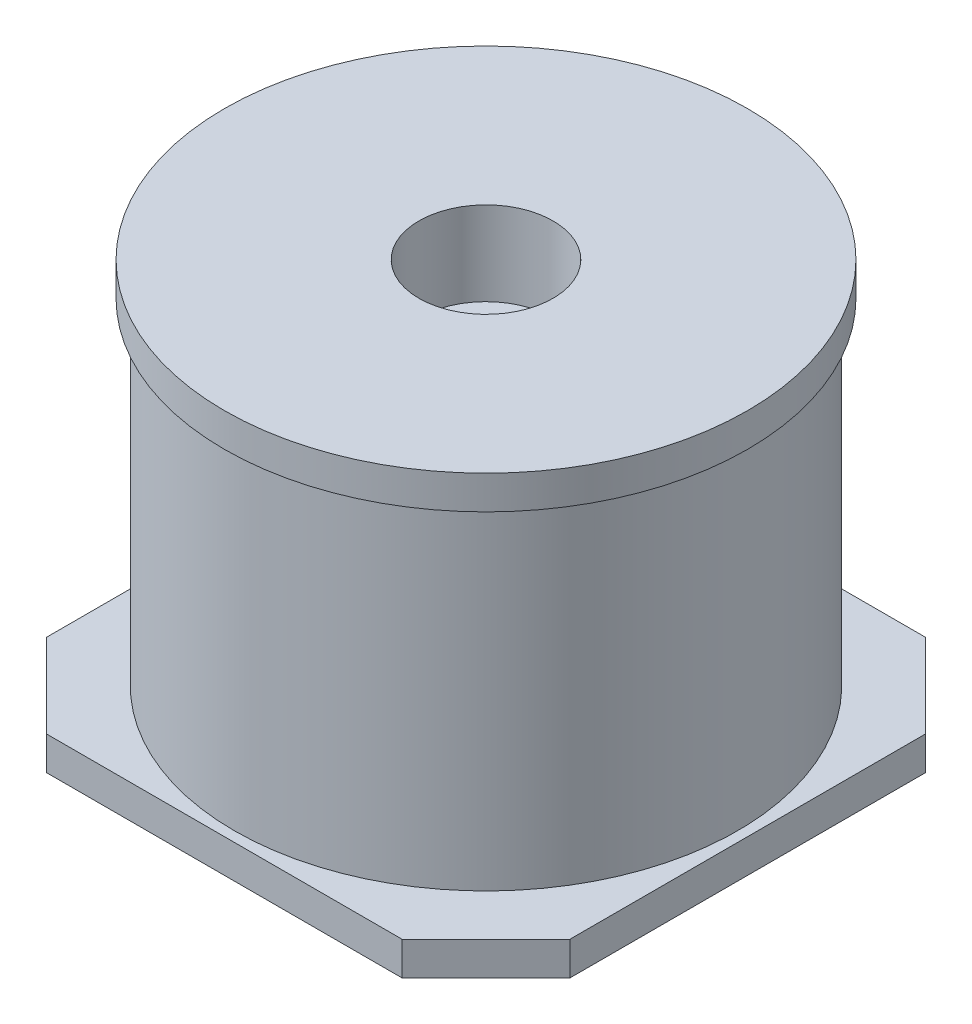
SolidWorks part; units mm, degrees
ref_plane "Front Plane" through (0, 0, 0) normal (0, 0, 1) x (1, 0, 0)
ref_plane "Top Plane" through (0, 0, 0) normal (0, 1, 0) x (1, 0, 0)
ref_plane "Right Plane" through (0, 0, 0) normal (1, 0, 0) x (0, 0, -1)
sketch "Sketch1" plane through (0, 0, 0) normal (0, 1, 0) x (1, 0, 0)
  circle A0 centre (0, 0) radius 3.81
extrude "Boss-Extrude1" add sketch "Sketch1" along normal blind 5.08
sketch "Sketch2" plane through (0, 5.08, 0) normal (0, 1, 0) x (1, 0, 0)
  circle A0 centre (0, 0) radius 3.9624
extrude "Boss-Extrude2" add sketch "Sketch2" along normal blind 0.508
sketch "Sketch3" plane through (0, 5.588, 0) normal (0, 1, 0) x (1, 0, 0)
  circle A0 centre (0, 0) radius 1.016
extrude "Cut-Extrude1" cut sketch "Sketch3" against normal blind 1.27
sketch "Sketch4" plane through (0, 0, 0) normal (0, -1, 0) x (1, 0, 0)
  line L0 (-3.9624, 2.6924) -> (-2.6924, 3.9624)
  line L1 (-2.6924, -3.9624) -> (2.6924, -3.9624)
  line L2 (-3.9624, -2.6924) -> (-3.9624, 2.6924)
  line L3 (-2.6924, 3.9624) -> (2.6924, 3.9624)
  line L4 (3.9624, -2.6924) -> (3.9624, 2.6924)
  line L5 (-3.9624, -3.9624) -> (3.9624, 3.9624) construction
  line L6 (-3.9624, 3.9624) -> (3.9624, -3.9624) construction
  line L7 (2.6924, 3.9624) -> (3.9624, 2.6924)
  line L8 (2.6924, -3.9624) -> (3.9624, -2.6924)
  line L9 (-3.9624, -2.6924) -> (-2.6924, -3.9624)
  point P0 (0, 0)
extrude "Boss-Extrude3" add sketch "Sketch4" along normal blind 0.508
sketch "Sketch5" plane through (0, -0.508, 0) normal (0, -1, 0) x (1, 0, 0)
  circle A0 centre (0, 0) radius 1.016
extrude "Cut-Extrude2" cut sketch "Sketch5" against normal blind 1.27
